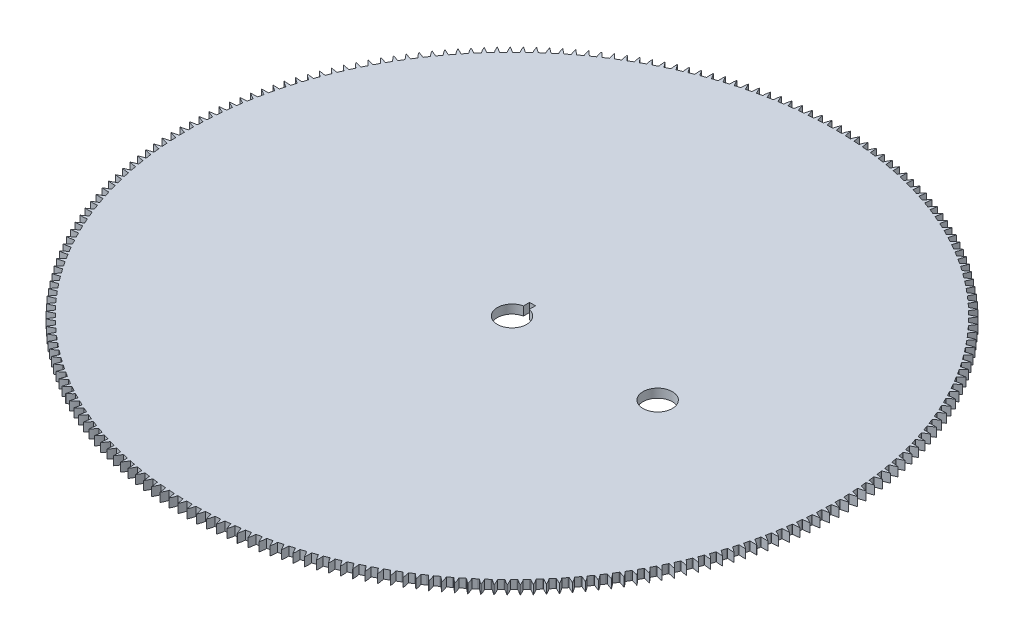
SolidWorks part; units mm, degrees
ref_plane "Front Plane" through (0, 0, 0) normal (0, 0, 1) x (1, 0, 0)
ref_plane "Top Plane" through (0, 0, 0) normal (0, 1, 0) x (1, 0, 0)
ref_plane "Right Plane" through (0, 0, 0) normal (1, 0, 0) x (0, 0, -1)
sketch "Sketch1" plane through (0, 0, 0) normal (0, 1, 0) x (1, 0, 0)
  line L0 (0, 0) -> (0, 53.9742) construction
  line L1 (0, 0) -> (-53.9742, 0) construction
  line L2 (0, 0) -> (-56.2486, -0.3962) construction
  line L3 (0, 0) -> (-53.9689, -0.7604) construction
  line L4 (0, 0) -> (-53.9528, -1.5206) construction
  circle A0 centre (0, 0) radius 55.75 construction
  circle A1 centre (0, 0) radius 53.9742 construction
  circle A2 centre (0, 0) radius 55.125 construction
  circle A3 centre (0, 0) radius 56.25 construction
  spline S0 degree 4 poles (-53.9742, 0) (-54.0235, 0) (-54.1219, -0.0023) (-54.3976, -0.0205) (-54.9164, -0.0854) (-55.7069, -0.2377) (-56.7591, -0.5226) (-58.0929, -0.9847) (-59.6238, -1.6441) (-61.2555, -2.4881) (-62.9679, -3.5289) (-64.6144, -4.674) (-66.194, -5.9096) (-67.7073, -7.2254) (-69.4639, -8.9091) (-71.4602, -11.0612) (-73.6203, -13.7358) (-75.8559, -16.9794) (-77.8889, -20.4383) (-79.6835, -24.0266) (-81.0503, -27.2594) (-82.0803, -30.0856) (-82.8461, -32.4712) (-83.4039, -34.3977) (-83.9076, -36.3363) (-84.3581, -38.293) (-84.7557, -40.2525) (-85.1017, -42.236) (-85.3959, -44.2044) (-85.6406, -46.2185) (-85.8338, -48.1714) (-85.9626, -49.9919) (-86.0385, -51.3811) (-86.0868, -52.7653) (-86.1051, -53.4887) (-86.1211, -54.4894) (-86.1238, -55.2624) (-86.1208, -56.1276) (-86.1084, -56.94) (-86.0889, -57.7851) (-86.0609, -58.6072) (-86.0344, -59.2385) (-86.0139, -59.6496) (-86.0031, -59.8592) knots 0 0 0 0 0 0.002688 0.005377 0.015084 0.028532 0.04661 0.064855 0.092111 0.119476 0.146842 0.174209 0.201575 0.228941 0.256307 0.307035 0.361767 0.4165 0.471232 0.525964 0.580697 0.608063 0.635429 0.662795 0.690161 0.717528 0.744894 0.77226 0.799626 0.826992 0.854358 0.881725 0.895408 0.909091 0.920455 0.931818 0.943182 0.954545 0.965909 0.977273 0.988636 1 1 1 1 1 construction
  spline S1 degree 4 poles (-53.9742, 0) (-54.0235, 0) (-54.1219, -0.0023) (-54.3976, -0.0205) (-54.9164, -0.0854) (-55.7069, -0.2377) (-56.7591, -0.5226) (-58.0929, -0.9847) (-59.6238, -1.6441) (-61.2555, -2.4881) (-62.9679, -3.5289) (-64.6144, -4.674) (-66.194, -5.9096) (-67.7073, -7.2254) (-69.4639, -8.9091) (-71.4602, -11.0612) (-73.6203, -13.7358) (-75.8559, -16.9794) (-77.8889, -20.4383) (-79.6835, -24.0266) (-81.0503, -27.2594) (-82.0803, -30.0856) (-82.8461, -32.4712) (-83.4039, -34.3977) (-83.9076, -36.3363) (-84.3581, -38.293) (-84.7557, -40.2525) (-85.1017, -42.236) (-85.3959, -44.2044) (-85.6406, -46.2185) (-85.8338, -48.1714) (-85.9626, -49.9919) (-86.0385, -51.3811) (-86.0785, -52.5273) (-86.0914, -52.9747) (-86.097, -53.2024) knots 0 0 0 0 0 0.002688 0.005377 0.015084 0.028532 0.04661 0.064855 0.092111 0.119476 0.146842 0.174209 0.201575 0.228941 0.256307 0.307035 0.361767 0.4165 0.471232 0.525964 0.580697 0.608063 0.635429 0.662795 0.690161 0.717528 0.744894 0.77226 0.799626 0.826992 0.854358 0.881725 0.895408 0.909091 0.909091 0.909091 0.909091 0.909091
  dimension "D1" = 112.5
  dimension "D2" = 111.5
  dimension "D3" = 107.9485
  dimension "D4" = 110.25
  dimension "D5" = 53.9742
  dimension "D6" = 0.404
  dimension "D7" = 0.807
  dimension "D8" = 1.614
sketch "Sketch2" plane through (0, 0, 0) normal (0, 1, 0) x (1, 0, 0)
  line L0 (0, 0) -> (-56.2486, -0.3962) construction
  line L1 (0, 0) -> (-56.2486, -0.3962) construction
  line L2 (0, 0) -> (-53.9689, -0.7604) construction
  line L3 (0, 0) -> (-53.9742, 0) construction
  line L4 (0, 0) -> (-53.9528, -1.5206) construction
  line L5 (0, 0) -> (-53.9689, -0.7604) construction
  line L6 (0, 0) -> (-53.9742, 0) construction
  line L7 (0, 0) -> (-53.9528, -1.5206) construction
  line L8 (-55.125, 0) -> (-55.1195, -0.7766) construction
  line L9 (-55.1195, -0.7766) -> (-55.1031, -1.553)
  line L10 (-55.1031, -1.553) -> (-53.9528, -1.5206) construction
  line L11 (-55.1031, -1.553) -> (-2.499, -0.0704)
  line L12 (-53.9742, 0) -> (-2.5, 0)
  line L13 (-53.9742, 0) -> (-55.125, 0)
  line L14 (-55.125, 0) -> (-55.1241, -0.1312)
  circle A0 centre (0, 0) radius 55.125 construction
  circle A1 centre (0, 0) radius 53.9742 construction
  circle A2 centre (0, 0) radius 55.75 construction
  circle A3 centre (0, 0) radius 56.25 construction
  circle A4 centre (0, 0) radius 55.125 construction
  circle A5 centre (0, 0) radius 53.9742 construction
  circle A6 centre (0, 0) radius 55.75 construction
  circle A7 centre (0, 0) radius 56.25 construction
  arc A8 (-56.2486, -0.4004) -> (-56.2486, -0.392) centre (0, 0) cw
  circle A11 centre (0, 0) radius 2.5 construction
  arc A12 (-2.5, 0) -> (-2.499, -0.0704) centre (0, 0) ccw
  spline S0 degree 4 poles (7.0666, 1998.4473) (-46.4874, -61.228) (-48.3447, -1.3043) (-51.6015, 0.3295) (-54.9164, -0.0854) (-55.7069, -0.2377) (-56.7591, -0.5226) (-58.0929, -0.9847) (-59.6238, -1.6441) (-61.2555, -2.4881) (-62.9679, -3.5289) (-64.6144, -4.674) (-66.194, -5.9096) (-67.7073, -7.2254) (-69.4639, -8.9091) (-71.4602, -11.0612) (-73.6203, -13.7358) (-75.8559, -16.9794) (-77.8889, -20.4383) (-79.6835, -24.0266) (-81.0503, -27.2594) (-82.0803, -30.0856) (-82.8461, -32.4712) (-83.4039, -34.3977) (-83.9076, -36.3363) (-84.3581, -38.293) (-84.7557, -40.2525) (-85.1017, -42.236) (-85.3959, -44.2044) (-85.6406, -46.2185) (-85.8338, -48.1714) (-85.9626, -49.9919) (-86.2032, -54.3966) (-86.2268, -62.3247) (-84.2314, 4.188) (-134.1673, -2052.2405) knots -0.153792 -0.153792 -0.153792 -0.153792 -0.153792 0.002688 0.005377 0.015084 0.028532 0.04661 0.064855 0.092111 0.119476 0.146842 0.174209 0.201575 0.228941 0.256307 0.307035 0.361767 0.4165 0.471232 0.525964 0.580697 0.608063 0.635429 0.662795 0.690161 0.717528 0.744894 0.77226 0.799626 0.826992 0.854358 0.881725 0.895408 1.087301 1.087301 1.087301 1.087301 1.087301 only from (-53.9742, 0) to (-86.097, -53.2024) construction
  spline S1 degree 4 poles (-55.1241, -0.1312) (-55.353, -0.1735) (-55.6354, -0.2338) (-55.916, -0.302) (-56.1947, -0.3772) (-56.2486, -0.392) knots 0.015819 0.015819 0.015819 0.015819 0.015819 0.028532 0.031584 0.031584 0.031584 0.031584 0.031584
  spline S2 degree 4 poles (-55.1195, -0.7766) (-55.1271, -0.7751) (-55.2126, -0.7585) (-55.4041, -0.712) (-55.6895, -0.6254) (-55.9614, -0.523) (-56.156, -0.4412) (-56.2486, -0.4004) knots 0.004428 0.004428 0.004428 0.004428 0.004428 0.005377 0.015084 0.028532 0.040915 0.040915 0.040915 0.040915 0.040915
  point P18 (-55.1223, -0.3883)
  point P24 (-55.1031, -1.553)
  dimension "D2" = 5
extrude "Boss-Extrude1" add sketch "Sketch2" along normal blind 1.5
pattern_circular "CirPattern1" count 223 over 360 of "Boss-Extrude1"
sketch "Sketch3" plane through (0, 1.5, 0) normal (0, 1, 0) x (1, 0, 0)
  line L1 (0.5, 1.5) -> (-0.5, 1.5)
  line L2 (0.5, 1.5) -> (0.5, 3.5)
  line L3 (0.5, 3.5) -> (-0.5, 3.5)
  line L4 (-0.5, 1.5) -> (-0.5, 3.5)
  line L5 (0.5, 1.5) -> (-0.5, 3.5) construction
  line L6 (0.5, 3.5) -> (-0.5, 1.5) construction
  circle A0 centre (0, 0) radius 2.5 construction
  point P0 (0, 2.5)
  dimension "D1" = 2
  dimension "D2" = 1
extrude "Cut-Extrude1" cut sketch "Sketch3" against normal up to surface (1.5 mm away)
sketch "Sketch4" plane through (0, 1.5, 0) normal (0, 1, 0) x (1, 0, 0)
  circle A0 centre (0, 0) radius 12.434 construction
  circle A1 centre (24.868, 0) radius 12.434 construction
  circle A2 centre (24.868, 0) radius 2.5
  dimension "D1" = 24.868
  dimension "D2" = 5
extrude "Cut-Extrude2" cut sketch "Sketch4" against normal up to surface (1.5 mm away)
equation "\"Module\"= .5"
equation "\"Number of Teeth\"= 223"
equation "\"Pressure Angle\"= 14.5deg"
equation "\"Pitch Diameter\"= \"Number of Teeth\" * \"Module\""
equation "\"Circular Pitch\"= pi * \"Module\""
equation "\"Addendum\"= \"Module\""
equation "\"Dedendum\"= 1.25 * \"Module\""
equation "\"Base Diameter\"= \"Pitch Diameter\" * cos ( \"Pressure Angle\" )"
equation "\"Base Radius\"= \"Base Diameter\" / 2"
equation "\"Width\"= 1.5mm"
equation "\"Outside Diameter\"= \"Pitch Diameter\" + 2 * \"Addendum\""
equation "\"D1@Sketch1\"=\"Outside Diameter\""
equation "\"D3@Sketch1\"=\"Base Diameter\""
equation "\"Root Diameter\"= \"Pitch Diameter\" - 2 * \"Dedendum\""
equation "\"D4@Sketch1\"=\"Root Diameter\""
equation "\"Tooth Angle\"= 360 / \"Number of Teeth\""
equation "\"D6@Sketch1\"=\"Tooth Angle\"/4"
equation "\"D7@Sketch1\"=\"Tooth Angle\"/2"
equation "\"D8@Sketch1\"=\"Tooth Angle\""
equation "\"D2@Sketch1\" = \"Pitch Diameter\""
equation "\"Shaft Diameter\"= 5mm"
equation "\"D1@CirPattern1\" = \"Number of Teeth\""
equation "\"D2@Sketch2\"  = \"Shaft Diameter\""
equation "\"D1@Boss-Extrude1\" = \"Width\""
